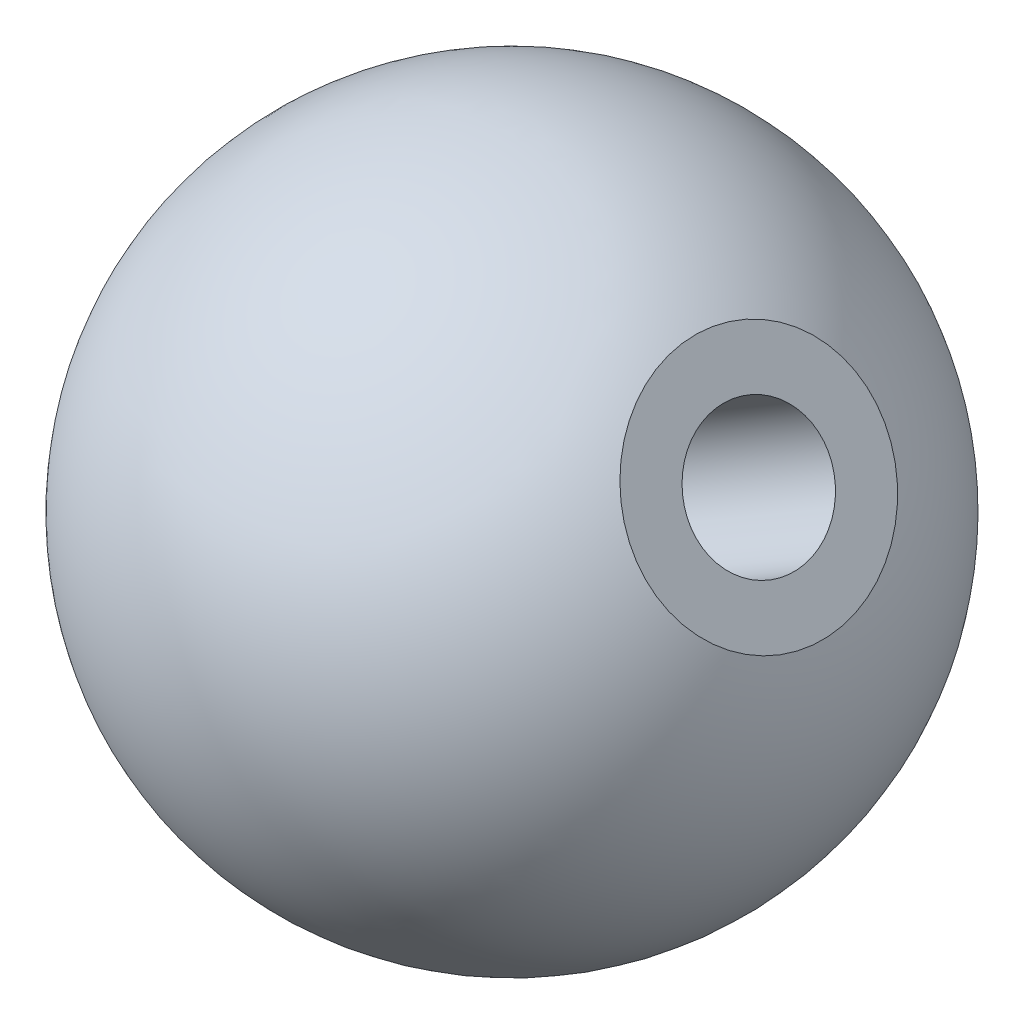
SolidWorks part; units mm, degrees
ref_plane "Front Plane" through (0, 0, 0) normal (0, 0, 1) x (1, 0, 0)
ref_plane "Top Plane" through (0, 0, 0) normal (0, 1, 0) x (1, 0, 0)
ref_plane "Right Plane" through (0, 0, 0) normal (1, 0, 0) x (0, 0, -1)
sketch "Sketch1" plane through (0, 0, 0) normal (0, 0, 1) x (1, 0, 0)
  line L0 (0, -10.5) -> (0, 10.5)
  arc A0 (0, 10.5) -> (0, -10.5) centre (0, 0) ccw
  dimension "D2" = 10.5
  dimension "D1" = 21
revolve "Revolve1" add sketch "Sketch1" angle 360 about L0
hole_wizard "M5 Tapped Hole1" positions "3DSketch1" profile "Sketch2" tap size "M5" standard "DIN"
sketch3d "3DSketch1"
  point P0 (8.9525, 5.4622, 0.5174)
sketch "Sketch2" plane through (8.9525, 5.4622, 0.5174) normal (-0.4271, 0.6394, 0.6394) x (-0.3011, 0.5662, -0.7673)
  line L0 (0, 0) -> (0, 13.6618)
  line L1 (0, 13.6618) -> (2.1, 12.4)
  line L2 (2.1, 12.4) -> (2.1, 0)
  line L5 (2.1, 0) -> (0, 0)
  line L10 (0, 13.6618) -> (-2.1, 12.4) construction
  line L11 (0, -6.35) -> (0, 107.95) construction
  dimension "Tap Drill Dia." = 4.2
  dimension "Tap Drill Depth" = 12.4
  dimension "Drill Angle" = 118
ref_plane "Plane1" through (8.7716, 5.3518, 0.507) normal (0.8526, 0.5202, 0.0493) x (0.0421, 0.0257, -0.9988)
sketch "Sketch3" plane through (8.7716, 5.3518, 0.507) normal (0.8526, 0.5202, 0.0493) x (0.0421, 0.0257, -0.9988)
  circle A0 centre (0, 0) radius 4.055
  dimension "D1" = 8.11
extrude "Cut-Extrude1" cut sketch "Sketch3" against normal blind 0.5
